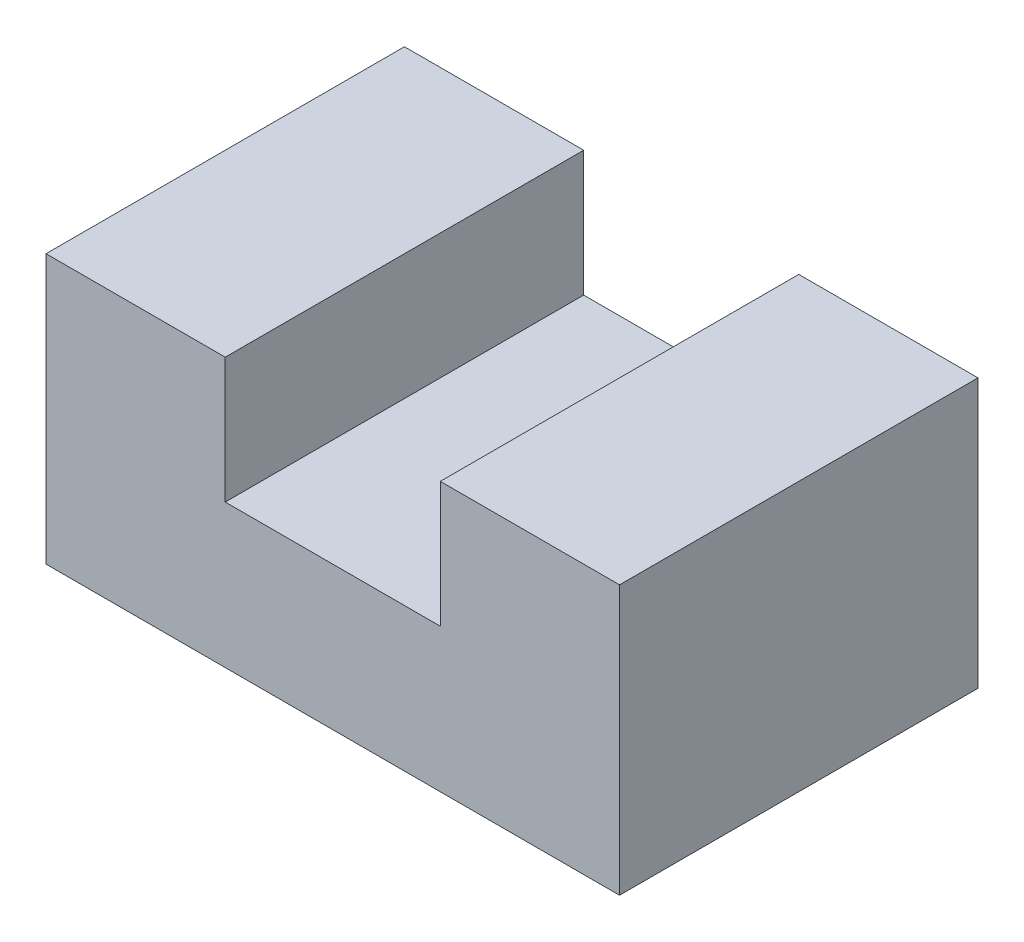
SolidWorks part; units mm, degrees
ref_plane "Front Plane" through (0, 0, 0) normal (0, 0, 1) x (1, 0, 0)
ref_plane "Top Plane" through (0, 0, 0) normal (0, 1, 0) x (1, 0, 0)
ref_plane "Right Plane" through (0, 0, 0) normal (1, 0, 0) x (0, 0, -1)
sketch "Sketch1" plane through (0, 0, 0) normal (0, 0, 1) x (1, 0, 0)
  line L0 (-80, 0) -> (80, 0)
  line L1 (80, 0) -> (80, 75)
  line L2 (80, 75) -> (30, 75)
  line L3 (30, 75) -> (30, 40)
  line L4 (30, 40) -> (-30, 40)
  line L5 (-30, 40) -> (-30, 75)
  line L6 (-30, 75) -> (-80, 75)
  line L7 (-80, 75) -> (-80, 0)
  point P4 (0, 0)
  dimension "D1" = 160
  dimension "D2" = 75
  dimension "D3" = 50
  dimension "D4" = 50
  dimension "D5" = 40
extrude "Boss-Extrude1" add sketch "Sketch1" along normal mid plane 100 contours L0 L1 L2 L3 L4 L5 L6 L7
